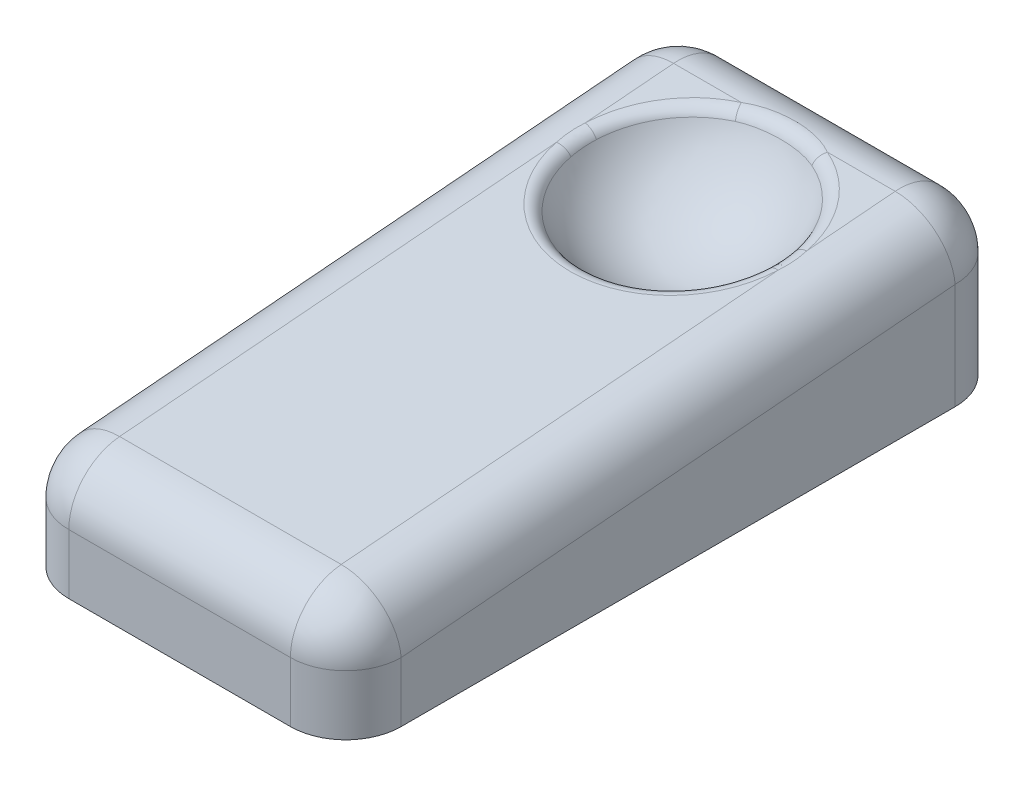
SolidWorks part; units mm, degrees
ref_plane "Front Plane" through (0, 0, 0) normal (0, 0, 1) x (1, 0, 0)
ref_plane "Top Plane" through (0, 0, 0) normal (0, 1, 0) x (1, 0, 0)
ref_plane "Right Plane" through (0, 0, 0) normal (1, 0, 0) x (0, 0, -1)
sketch "Sketch1" plane through (0, 0, 0) normal (0, 1, 0) x (1, 0, 0)
  line L0 (0, 0) -> (0, 76.2) construction
  line L1 (-76.2, 76.2) -> (76.2, 76.2)
  line L2 (-76.2, 76.2) -> (-76.2, -228.6)
  line L3 (-76.2, -228.6) -> (76.2, -228.6)
  line L4 (76.2, 76.2) -> (76.2, -228.6)
  dimension "D1" = 152.4
  dimension "D2" = 304.8
  dimension "D3" = 76.2
extrude "Boss-Extrude1" add sketch "Sketch1" along normal blind 76.2
ref_plane "Plane1" through (0, 88.9, 0) normal (0, 1, 0) x (-1, 0, 0)
sketch "Sketch2" plane through (0, 88.9, 0) normal (0, 1, 0) x (1, 0, 0)
  line L0 (-50.8, 0) -> (50.8, 0)
  arc A0 (50.8, 0) -> (-50.8, 0) centre (0, 0) ccw
  dimension "D1" = 50.8
revolve "Cut-Revolve1" cut sketch "Sketch2" angle 360 about L0
sketch "Sketch3" plane through (76.2, 0, 0) normal (1, 0, 0) x (0, 0, -1)
  line L0 (76.2, 76.2) -> (-228.6, 50.8)
  line L1 (-228.6, 76.2) -> (-228.6, 0) construction
  line L2 (-228.6, 50.8) -> (-228.6, 76.2)
  line L3 (-228.6, 76.2) -> (76.2, 76.2)
  dimension "D1" = 25.4
extrude "Cut-Extrude1" cut sketch "Sketch3" against normal through all
fillet "Fillet1" radius 25.4 4 edges at (-76.2, 25.4, 228.6) (76.2, 25.4, 228.6) (76.2, 38.1, -76.2) (-76.2, 38.1, -76.2)
fillet "Fillet2" radius 25.4 8 edges at (-68.7605, 51.42, 221.1605) (0, 50.8, 228.6) (68.7605, 51.42, 221.1605) (76.2, 63.5, 76.2) (68.7605, 75.58, -68.7605) (0, 76.2, -76.2) (-68.7605, 75.58, -68.7605) (-76.2, 63.5, 76.2)
fillet "Fillet3" radius 6.35 1 edges at (0, 73.8944, -48.5332)
